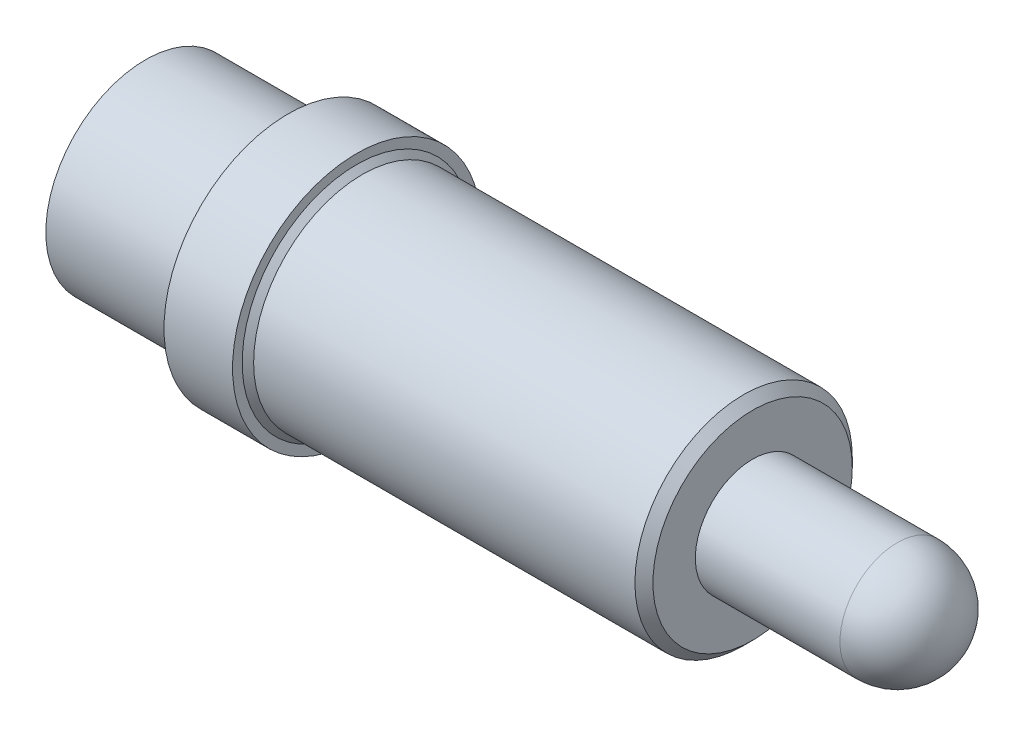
SolidWorks part; units mm, degrees
ref_plane "Front Plane" through (0, 0, 0) normal (0, 0, 1) x (1, 0, 0)
ref_plane "Top Plane" through (0, 0, 0) normal (0, 1, 0) x (1, 0, 0)
ref_plane "Right Plane" through (0, 0, 0) normal (1, 0, 0) x (0, 0, -1)
sketch "Sketch1" plane through (0, 0, 0) normal (0, 0, 1) x (1, 0, 0)
  line L0 (0, 0) -> (-23.7325, 0) construction
  line L1 (1.5125, 0) -> (-1.5125, 0) construction
  line L2 (0, 0) -> (0, 1.105)
  line L3 (0, 1.105) -> (1.58, 1.105)
  line L4 (1.58, 1.105) -> (1.58, 1.375)
  line L5 (1.58, 1.375) -> (2.34, 1.375)
  line L8 (2.34, 1.375) -> (2.34, 1.205)
  line L9 (6.73, 0.635) -> (8.333, 0.635)
  line L10 (8.968, 0) -> (0, 0)
  line L11 (2.34, 1.205) -> (6.73, 1.205)
  line L12 (6.73, 1.205) -> (6.73, 0.635)
  arc A0 (8.333, 0.635) -> (8.968, 0) centre (8.333, 0) cw
  dimension "D1" = 2.21
  dimension "D2" = 2.75
  dimension "D3" = 2.34
  dimension "D4" = 2.41
  dimension "D5" = 1.27
  dimension "D6" = 6.73
  dimension "D7" = 0.76
  dimension "D10" = 8.968
revolve "Revolve1" add sketch "Sketch1" angle 360 about L0
chamfer "Chamfer1" distance 0.0635 angle 45 1 edges at (2.34, 0, -1.205)
chamfer "Chamfer2" distance 0.1 angle 45 1 edges at (6.73, 0, -1.205)
